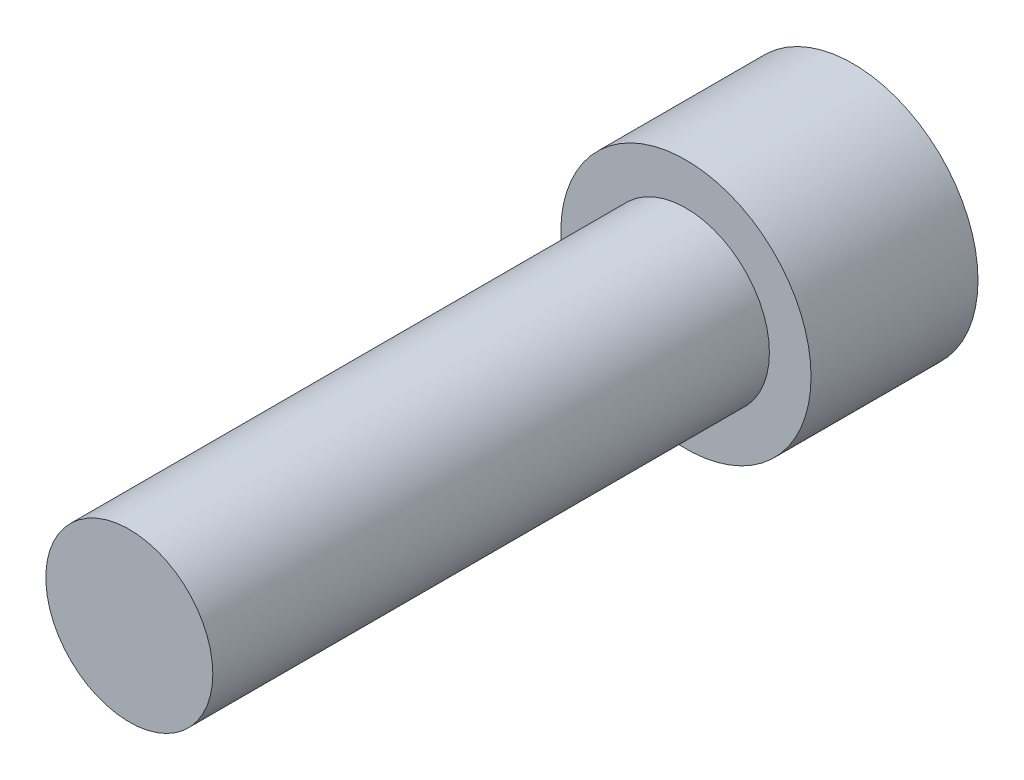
SolidWorks part; units mm, degrees
ref_plane "Front Plane" through (0, 0, 0) normal (0, 0, 1) x (1, 0, 0)
ref_plane "Top Plane" through (0, 0, 0) normal (0, 1, 0) x (1, 0, 0)
ref_plane "Right Plane" through (0, 0, 0) normal (1, 0, 0) x (0, 0, -1)
sketch "Sketch6" plane through (0, 0, 0) normal (1, 0, 0) x (0, 0, -1)
  line L0 (-31.75, 0) -> (22.525, 0) construction
  line L1 (7.8511, 0) -> (-7.8511, 0) construction
  line L2 (-31.75, 0) -> (-31.75, -4.7625)
  line L3 (-31.75, -4.7625) -> (0, -4.7625)
  line L4 (0, 7.8511) -> (0, -7.8511) construction
  line L5 (0, -4.7625) -> (0, -7.1374)
  line L6 (0, -7.1374) -> (9.525, -7.1374)
  line L7 (9.525, -7.1374) -> (9.525, 0)
  line L8 (9.525, 0) -> (-31.75, 0)
  dimension "L" = 31.75
  dimension "H" = 9.525
  dimension "A" = 14.2748
  dimension "D" = 9.525
revolve "Revolve1" add sketch "Sketch6" angle 360 about L0
sketch "Sketch7" plane through (0, 0, -9.525) normal (0, 0, -1) x (-1, 0, 0)
  line L2 (-3.9624, 2.2877) -> (-3.9624, -2.2877)
  line L4 (-3.9624, -2.2877) -> (0, -4.5754)
  line L5 (0, -4.5754) -> (3.9624, -2.2877)
  line L6 (3.9624, -2.2877) -> (3.9624, 2.2877)
  line L7 (3.9624, 2.2877) -> (0, 4.5754)
  line L8 (0, 4.5754) -> (-3.9624, 2.2877)
  circle A0 centre (0, 0) radius 3.9624 construction
  dimension "J" = 7.9248
extrude "HEX" cut sketch "Sketch7" against normal blind 5.842
